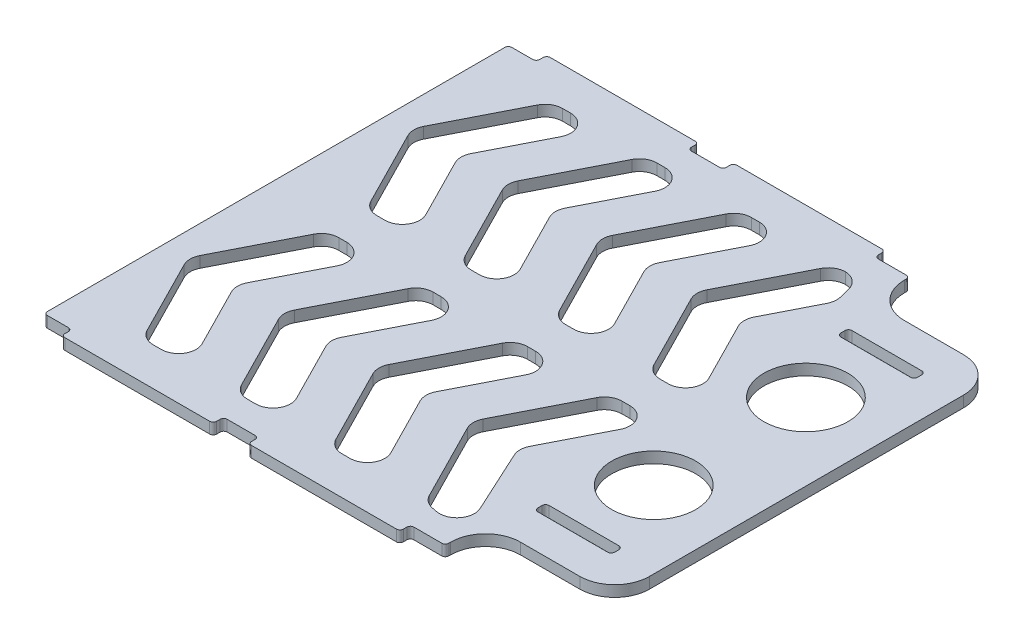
SolidWorks part; units mm, degrees
ref_plane "Front Plane" through (0, 0, 0) normal (0, 0, 1) x (1, 0, 0)
ref_plane "Top Plane" through (0, 0, 0) normal (0, 1, 0) x (1, 0, 0)
ref_plane "Right Plane" through (0, 0, 0) normal (1, 0, 0) x (0, 0, -1)
sketch "Sketch1" plane through (0, 0, 0) normal (0, 1, 0) x (1, 0, 0)
  line L0 (1.5, 84.675) -> (244.5, 84.675) construction
  line L1 (90.5, 165.91) -> (207.5, 165.91)
  line L2 (98.5, 18.14) -> (98.5, 14.94)
  line L4 (244.5, 29.675) -> (244.5, 139.675)
  line L5 (98.5, 154.41) -> (197.5, 154.41)
  line L6 (98.5, 154.41) -> (98.5, 151.21)
  line L7 (98.5, 151.21) -> (197.5, 151.21)
  line L8 (197.5, 154.41) -> (197.5, 151.21)
  line L11 (244.5, 29.675) -> (207.5, 29.675)
  line L12 (207.5, 3.44) -> (207.5, 29.675)
  line L19 (244.5, 139.675) -> (207.5, 139.675)
  line L20 (207.5, 165.91) -> (207.5, 139.675)
  line L21 (98.5, 18.14) -> (197.5, 18.14)
  line L23 (98.5, 14.94) -> (197.5, 14.94)
  line L24 (197.5, 18.14) -> (197.5, 14.94)
  line L25 (90.5, 165.91) -> (90.5, 3.44) construction
  line L26 (211.5, 42.875) -> (233.5, 42.875)
  line L27 (211.5, 42.875) -> (211.5, 39.675)
  line L28 (211.5, 39.675) -> (233.5, 39.675)
  line L29 (233.5, 42.875) -> (233.5, 39.675)
  line L30 (211.5, 129.675) -> (233.5, 129.675)
  line L31 (211.5, 129.675) -> (211.5, 126.475)
  line L32 (211.5, 126.475) -> (233.5, 126.475)
  line L33 (233.5, 129.675) -> (233.5, 126.475)
  line L34 (90.5, 165.91) -> (90.5, 3.44)
  line L36 (90.5, 3.44) -> (207.5, 3.44)
  dimension "D2" = 99
  dimension "D3" = 10
  dimension "D4" = 3.2
  dimension "D5" = 3.2
  dimension "D6" = 10
  dimension "D7" = 99
  dimension "D8" = 11.5
  dimension "D9" = 3.2
  dimension "D10" = 22
  dimension "D11" = 10
  dimension "D12" = 10
  dimension "D13" = 22
  dimension "D14" = 11
  dimension "D15" = 11
  dimension "D16" = 11.5
  dimension "D17" = 11.5
extrude "Boss-Extrude1" add sketch "Sketch1" along normal blind 3.175
fillet "Fillet1" radius 10 6 edges at (207.5, 1.5875, -29.675) (207.5, 1.5875, -3.44) (244.5, 1.5875, -29.675) (244.5, 1.5875, -139.675) (207.5, 1.5875, -139.675) (207.5, 1.5875, -165.91)
fillet "Fillet3" radius 5 2 edges at (90.5, 1.5875, -165.91) (90.5, 1.5875, -3.44)
sketch "Sketch2" plane through (0, 3.175, 0) normal (0, 1, 0) x (1, 0, 0)
  line L0 (207.5, 84.675) -> (207.5, 19.675) construction
  line L1 (90.5, 160.91) -> (90.5, 8.44) construction
  line L2 (244.5, 84.675) -> (90.5, 84.675) construction
  line L3 (244.5, 39.675) -> (244.5, 129.675) construction
  line L4 (210.4289, 26.7461) -> (90.5, 26.7461) construction
  line L5 (207.5, 116.7311) -> (207.5, 90.1392) construction
  line L6 (99.3213, 143.323) -> (99.3213, 90.1392) construction
  line L7 (99.3213, 90.1392) -> (207.5, 90.1392) construction
  line L8 (99.3213, 116.7311) -> (207.5, 116.7311) construction
  line L9 (178.9822, 80.9702) -> (178.9822, 80.8443) construction
  line L10 (200.75, 143.323) -> (99.3213, 143.323) construction
  line L11 (153.4107, 90.1392) -> (153.4107, 143.323) construction
  line L12 (112.8437, 143.323) -> (99.3213, 116.7311)
  line L13 (99.3213, 116.7311) -> (112.8437, 90.1392)
  line L14 (126.366, 143.323) -> (126.366, 90.1392) construction
  line L15 (126.366, 90.1392) -> (99.3213, 90.1392) construction
  line L16 (99.3213, 90.1392) -> (112.8437, 90.1392) construction
  line L17 (112.8437, 90.1392) -> (112.8437, 143.323) construction
  line L18 (112.8437, 90.1392) -> (126.366, 90.1392)
  line L19 (126.366, 90.1392) -> (112.8437, 116.7311)
  line L20 (112.8437, 116.7311) -> (126.366, 143.323)
  line L21 (139.8883, 143.323) -> (139.8883, 90.1392) construction
  line L22 (139.8883, 90.1392) -> (153.4107, 90.1392) construction
  line L23 (153.4107, 90.1392) -> (207.5, 90.1392) construction
  line L24 (207.5, 90.1392) -> (180.4553, 90.1392) construction
  line L25 (180.4553, 90.1392) -> (180.4553, 143.323) construction
  line L26 (126.366, 143.323) -> (112.8437, 143.323)
  line L27 (139.8883, 143.323) -> (126.366, 116.7311)
  line L28 (166.933, 143.323) -> (166.933, 90.1392) construction
  line L29 (166.933, 90.1392) -> (180.4553, 90.1392) construction
  line L30 (180.4553, 90.1392) -> (207.5, 90.1392) construction
  line L31 (207.5, 90.1392) -> (193.9777, 90.1392) construction
  line L32 (193.9777, 90.1392) -> (193.9777, 143.323) construction
  line L33 (126.366, 116.7311) -> (139.8883, 90.1392)
  line L34 (139.8883, 90.1392) -> (153.4107, 90.1392)
  line L35 (153.4107, 90.1392) -> (139.8883, 116.7311)
  line L36 (139.8883, 116.7311) -> (153.4107, 143.323)
  line L37 (153.4107, 143.323) -> (139.8883, 143.323)
  line L38 (166.933, 143.323) -> (153.4107, 116.7311)
  line L39 (153.4107, 116.7311) -> (166.933, 90.1392)
  line L40 (166.933, 90.1392) -> (180.4553, 90.1392)
  line L41 (180.4553, 90.1392) -> (166.933, 116.7311)
  line L42 (166.933, 116.7311) -> (180.4553, 143.323)
  line L43 (180.4553, 143.323) -> (166.933, 143.323)
  line L44 (193.9777, 143.323) -> (180.4553, 116.7311)
  line L45 (180.4553, 116.7311) -> (193.9777, 90.1392)
  line L46 (193.9777, 90.1392) -> (207.5, 90.1392)
  line L47 (207.5, 90.1392) -> (193.9777, 116.7311)
  line L48 (193.9777, 116.7311) -> (203.018, 134.5091)
  line L49 (200.75, 143.323) -> (193.9777, 143.323)
  line L50 (193.9777, 79.2108) -> (193.9777, 26.027) construction
  line L51 (207.5, 79.2108) -> (193.9777, 79.2108) construction
  line L52 (180.4553, 79.2108) -> (207.5, 79.2108) construction
  line L53 (166.933, 79.2108) -> (180.4553, 79.2108) construction
  line L54 (166.933, 26.027) -> (166.933, 79.2108) construction
  line L55 (180.4553, 79.2108) -> (180.4553, 26.027) construction
  line L56 (207.5, 79.2108) -> (180.4553, 79.2108) construction
  line L57 (153.4107, 79.2108) -> (207.5, 79.2108) construction
  line L58 (139.8883, 79.2108) -> (153.4107, 79.2108) construction
  line L59 (139.8883, 26.027) -> (139.8883, 79.2108) construction
  line L60 (112.8437, 79.2108) -> (112.8437, 26.027) construction
  line L61 (99.3213, 79.2108) -> (112.8437, 79.2108) construction
  line L62 (126.366, 79.2108) -> (99.3213, 79.2108) construction
  line L63 (126.366, 26.027) -> (126.366, 79.2108) construction
  line L64 (153.4107, 79.2108) -> (153.4107, 26.027) construction
  line L65 (207.5, 23.3061) -> (99.3213, 26.027) construction
  line L66 (99.3213, 52.6189) -> (207.5, 52.6189) construction
  line L67 (99.3213, 79.2108) -> (207.5, 79.2108) construction
  line L68 (99.3213, 26.027) -> (99.3213, 79.2108) construction
  line L69 (207.5, 23.3061) -> (207.5, 79.2108) construction
  line L70 (207.5, 23.3061) -> (193.9777, 26.027)
  line L71 (193.9777, 52.6189) -> (207.5, 23.3061)
  line L72 (207.5, 79.2108) -> (193.9777, 52.6189)
  line L73 (193.9777, 79.2108) -> (207.5, 79.2108)
  line L74 (180.4553, 52.6189) -> (193.9777, 79.2108)
  line L75 (193.9777, 26.027) -> (180.4553, 52.6189)
  line L76 (180.4553, 26.027) -> (166.933, 26.027)
  line L77 (166.933, 52.6189) -> (180.4553, 26.027)
  line L78 (180.4553, 79.2108) -> (166.933, 52.6189)
  line L79 (166.933, 79.2108) -> (180.4553, 79.2108)
  line L80 (153.4107, 52.6189) -> (166.933, 79.2108)
  line L81 (166.933, 26.027) -> (153.4107, 52.6189)
  line L82 (153.4107, 26.027) -> (139.8883, 26.027)
  line L83 (139.8883, 52.6189) -> (153.4107, 26.027)
  line L84 (153.4107, 79.2108) -> (139.8883, 52.6189)
  line L85 (139.8883, 79.2108) -> (153.4107, 79.2108)
  line L86 (126.366, 52.6189) -> (139.8883, 79.2108)
  line L87 (139.8883, 26.027) -> (126.366, 52.6189)
  line L88 (126.366, 26.027) -> (112.8437, 26.027)
  line L89 (112.8437, 52.6189) -> (126.366, 26.027)
  line L90 (126.366, 79.2108) -> (112.8437, 52.6189)
  line L91 (112.8437, 79.2108) -> (126.366, 79.2108)
  line L92 (99.3213, 52.6189) -> (112.8437, 79.2108)
  line L93 (112.8437, 26.027) -> (99.3213, 52.6189)
  line L94 (200.75, 143.323) -> (203.018, 134.5091)
  line L95 (222.5, 126.475) -> (222.5, 42.875) construction
  line L96 (211.5, 126.475) -> (233.5, 126.475) construction
  line L97 (211.5, 42.875) -> (233.5, 42.875) construction
  arc A1 (217.5, 29.675) -> (207.5, 19.675) centre (217.5, 19.675) ccw construction
  circle A3 centre (222.5, 106.475) radius 12.0415
  circle A4 centre (222.5, 62.875) radius 12.0415
  dimension "D1" = 20
  dimension "D2" = 20
extrude "Cut-Extrude1" cut sketch "Sketch2" against normal blind 10
fillet "Fillet5" radius 5 49 edges at (112.8437, 1.5875, -143.323) (126.366, 1.5875, -143.323) (112.8437, 1.5875, -116.7311) (126.366, 1.5875, -90.1392) (112.8437, 1.5875, -90.1392) (99.3213, 1.5875, -116.7311) (153.4107, 1.5875, -90.1392) (139.8883, 1.5875, -90.1392) (126.366, 1.5875, -116.7311) (139.8883, 1.5875, -143.323) (153.4107, 1.5875, -143.323) (139.8883, 1.5875, -116.7311) (193.9777, 1.5875, -90.1392) (180.4553, 1.5875, -116.7311) (193.9777, 1.5875, -143.323) (203.018, 1.5875, -134.5091) (193.9777, 1.5875, -116.7311) (207.5, 1.5875, -90.1392) (166.933, 1.5875, -116.7311) (180.4553, 1.5875, -90.1392) (166.933, 1.5875, -90.1392) (153.4107, 1.5875, -116.7311) (166.933, 1.5875, -143.323) (180.4553, 1.5875, -143.323) (207.5, 1.5875, -79.2108) (193.9777, 1.5875, -52.6189) (207.5, 1.5875, -23.3061) (193.9777, 1.5875, -26.027) (180.4553, 1.5875, -52.6189) (193.9777, 1.5875, -79.2108) (166.933, 1.5875, -52.6189) (180.4553, 1.5875, -26.027) (166.933, 1.5875, -26.027) (153.4107, 1.5875, -52.6189) (166.933, 1.5875, -79.2108) (180.4553, 1.5875, -79.2108) (139.8883, 1.5875, -52.6189) (153.4107, 1.5875, -26.027) (139.8883, 1.5875, -26.027) (126.366, 1.5875, -52.6189) (139.8883, 1.5875, -79.2108) (153.4107, 1.5875, -79.2108) (126.366, 1.5875, -79.2108) (112.8437, 1.5875, -52.6189) (126.366, 1.5875, -26.027) (112.8437, 1.5875, -26.027) (99.3213, 1.5875, -52.6189) (112.8437, 1.5875, -79.2108) (200.75, 1.5875, -143.323)
sketch "Sketch3" plane through (0, 0, 0) normal (0, -1, 0) x (-1, 0, 0)
  line L0 (-207.5, 18.14) -> (-207.5, -6.8391)
  line L1 (-207.5, 13.44) -> (-207.5, 19.675) construction
  line L2 (-207.5, -6.8391) -> (-84.3691, -6.8391)
  line L3 (-84.3691, -6.8391) -> (-84.3691, 18.14)
  line L4 (-84.3691, 18.14) -> (-207.5, 18.14)
  line L5 (-76.7084, 151.21) -> (-217.244, 151.21)
  line L6 (-217.244, 151.21) -> (-217.244, 178.0229)
  line L7 (-217.244, 178.0229) -> (-76.7084, 178.0229)
  line L8 (-76.7084, 178.0229) -> (-76.7084, 151.21)
extrude "Cut-Extrude2" cut sketch "Sketch3" against normal blind 10
sketch "Sketch5" plane through (0, 0, -151.21) normal (0, 0, -1) x (-1, 0, 0)
  line L0 (-90.5, 0) -> (-207.5, 0) construction
  line L1 (-197.5, 3.175) -> (-154, 3.175)
  line L2 (-197.5, 3.175) -> (-197.5, 0)
  line L3 (-197.5, 0) -> (-154, 0)
  line L4 (-100.5, 3.175) -> (-100.5, 0)
  line L5 (-149, 3.175) -> (-149, 0) construction
  line L6 (-154, 3.175) -> (-154, 0)
  line L7 (-144, 3.175) -> (-144, 0)
  line L8 (-144, 3.175) -> (-100.5, 3.175)
  line L9 (-144, 0) -> (-100.5, 0)
  dimension "D1" = 10
  dimension "D2" = 10
  dimension "D3" = 5
  dimension "D4" = 5
extrude "Boss-Extrude2" add sketch "Sketch5" along normal blind 3
sketch "Sketch6" plane through (0, 0, -18.14) normal (0, 0, 1) x (1, 0, 0)
  line L0 (90.5, 3.175) -> (207.5, 3.175) construction
  line L1 (100.5, 3.175) -> (144, 3.175)
  line L2 (100.5, 3.175) -> (100.5, 0)
  line L3 (100.5, 0) -> (144, 0)
  line L4 (197.5, 3.175) -> (197.5, 0)
  line L5 (90.5, 0) -> (207.5, 0) construction
  line L6 (149, 3.175) -> (149, -2.8749) construction
  line L7 (144, 3.175) -> (144, 0)
  line L8 (154, 3.175) -> (154, 0)
  line L9 (154, 3.175) -> (197.5, 3.175)
  line L10 (154, 0) -> (197.5, 0)
  dimension "D1" = 10
  dimension "D2" = 10
  dimension "D3" = 5
  dimension "D4" = 5
extrude "Boss-Extrude3" add sketch "Sketch6" along normal blind 3
fillet "Fillet6" radius 1 20 edges at (211.5, 1.5875, -42.875) (211.5, 1.5875, -39.675) (233.5, 1.5875, -39.675) (233.5, 1.5875, -42.875) (211.5, 1.5875, -129.675) (211.5, 1.5875, -126.475) (233.5, 1.5875, -126.475) (233.5, 1.5875, -129.675) (100.5, 1.5875, -151.21) (100.5, 1.5875, -154.21) (197.5, 1.5875, -154.21) (207.5, 1.5875, -151.21) (207.5, 1.5875, -18.14) (197.5, 1.5875, -18.14) (197.5, 1.5875, -15.14) (100.5, 1.5875, -15.14) (90.5, 1.5875, -18.14) (90.5, 1.5875, -151.21)
fillet "Fillet7" radius 1 8 edges at (144, 1.5875, -154.21) (154, 1.5875, -154.21) (154, 1.5875, -15.14) (154, 1.5875, -18.14) (144, 1.5875, -15.14) (144, 1.5875, -151.21)
sketch "Sketch7" plane through (0, 3.175, 0) normal (0, 1, 0) x (1, 0, 0)
  line L0 (91.5, 151.21) -> (99.5, 151.21) construction
  line L1 (92.5, 151.21) -> (74.1298, 151.21)
  line L2 (92.5, 151.21) -> (92.5, 16.3941)
  line L3 (92.5, 16.3941) -> (74.1298, 16.3941)
  line L4 (74.1298, 151.21) -> (74.1298, 16.3941)
  line L5 (90.5, 150.21) -> (90.5, 19.14) construction
  dimension "D1" = 2
extrude "Cut-Extrude3" cut sketch "Sketch7" against normal blind 10
fillet "Fillet8" radius 1 2 edges at (92.5, 1.5875, -18.14) (92.5, 1.5875, -151.21)
